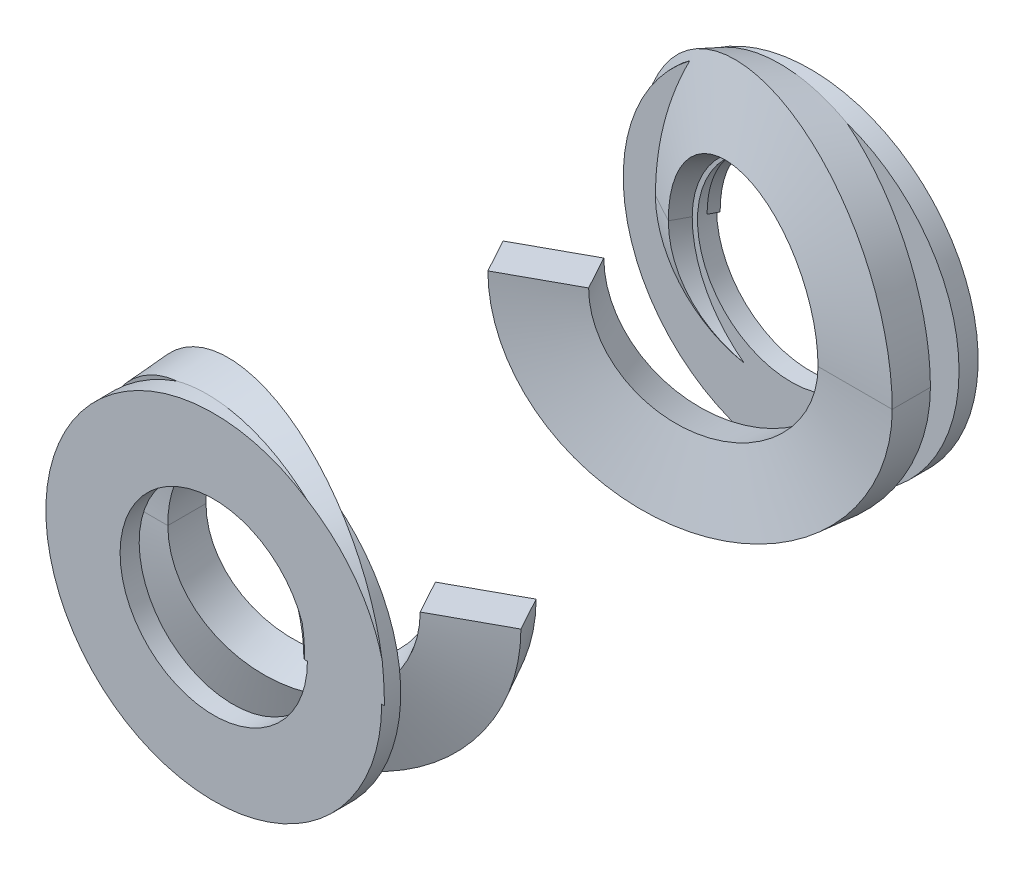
SolidWorks part; units mm, degrees
ref_plane "Front" through (0, 0, 0) normal (0, 0, 1) x (1, 0, 0)
ref_plane "Top" through (0, 0, 0) normal (0, 1, 0) x (1, 0, 0)
ref_plane "Right" through (0, 0, 0) normal (1, 0, 0) x (0, 0, -1)
sketch "Logo3_Revol_Axis" plane through (0, 0, 0) normal (0, 1, 0) x (1, 0, 0)
  line L0 (0, -30.1034) -> (0, 30.1034) construction
sketch "Logo3_bib0" plane through (0, 0, 0) normal (0, 1, 0) x (1, 0, 0)
  line L0 (-12.7, 0) -> (12.7, 0) construction
  line L1 (0, 0) -> (0, 42.862) construction
  dimension "logo3_d1" = 25.4
  dimension "logo3_l1" = 42.862
sketch "logo3_bib1" plane through (0, 0, 0) normal (0, 1, 0) x (1, 0, 0)
  line L0 (-12.7, 0) -> (12.7, 0) construction
  line L1 (12.7, 0) -> (12.7, 42.862) construction
  line L2 (12.7, 42.862) -> (-12.7, 42.862) construction
  line L3 (-12.7, 42.862) -> (-12.7, 0) construction
  line L4 (12.065, 0) -> (12.065, 42.862) construction
  line L5 (-12.065, 44.2336) -> (-12.065, 0) construction
  line L6 (6.731, 0) -> (6.731, 42.862) construction
  line L7 (-6.731, 0) -> (-6.731, 44.2336) construction
  line L8 (0, 0) -> (0, 42.862) construction
  line L9 (9.398, 42.862) -> (9.398, 0) construction
  line L10 (-9.398, 42.862) -> (-9.398, 0) construction
  line L11 (9.398, 0) -> (-9.398, 4.8006) construction
  line L12 (0, 2.4003) -> (0.7424, 5.307) construction
  line L13 (-9.398, 4.8006) -> (9.398, 9.6012) construction
  line L14 (-9.398, 42.862) -> (9.398, 38.0614) construction
  line L15 (9.398, 9.6012) -> (-9.398, 14.4018) construction
  line L16 (0, 7.2009) -> (-0.7424, 10.1076) construction
  line L17 (0, 12.0015) -> (0.7424, 14.9082) construction
  line L18 (0, 40.4617) -> (-0.7424, 37.555) construction
  line L19 (-22.523, 52.4632) -> (29.4917, 52.4632) construction
  line L20 (-22.523, -19.2024) -> (25.6601, -19.2024) construction
  line L21 (9.398, 38.0614) -> (-9.398, 33.2608) construction
  line L22 (0, 35.6611) -> (0.7424, 32.7544) construction
  line L23 (0, 0) -> (-0.7424, 2.9067) construction
  line L24 (-12.065, 44.2336) -> (-6.731, 44.2336)
  line L25 (-12.065, 44.2336) -> (-12.065, 41.4904)
  line L26 (-12.065, 41.4904) -> (-6.731, 41.4904)
  line L27 (-6.731, 44.2336) -> (-6.731, 41.4904)
  line L28 (6.731, -1.3716) -> (12.065, -1.3716)
  line L29 (6.731, -1.3716) -> (6.731, 1.3716)
  line L30 (6.731, 1.3716) -> (12.065, 1.3716)
  line L31 (12.065, -1.3716) -> (12.065, 1.3716)
  line L32 (0, 42.862) -> (0.7424, 39.9553) construction
  circle A1 centre (9.398, 38.0614) radius 2.667
  circle A2 centre (9.398, 9.6012) radius 2.667
  circle A4 centre (-9.398, 4.8006) radius 2.667
  circle A5 centre (-9.398, 14.4018) radius 2.667
  circle A6 centre (-9.398, 33.2608) radius 2.667
sketch "Sketch4" plane through (0, 0, 0) normal (0, 1, 0) x (1, 0, 0)
  line L0 (0, 0) -> (0, 42.862) construction
  line L1 (0, 0) -> (0, 42.862) construction
  line L2 (-12.065, 44.2336) -> (-12.065, 41.4904) construction
  line L3 (-12.065, 41.4904) -> (-6.731, 41.4904) construction
  line L4 (-6.731, 44.2336) -> (-6.731, 41.4904) construction
  line L5 (-12.065, 44.2336) -> (-6.731, 44.2336) construction
  line L6 (-12.065, 44.2336) -> (-12.065, 41.4904)
  line L7 (-12.065, 41.4904) -> (-6.731, 41.4904)
  line L8 (-6.731, 44.2336) -> (-6.731, 41.4904)
  line L9 (-12.065, 44.2336) -> (-6.731, 44.2336)
  line L10 (6.731, -1.3716) -> (6.731, 1.3716) construction
  line L11 (6.731, 1.3716) -> (12.065, 1.3716) construction
  line L12 (12.065, -1.3716) -> (12.065, 1.3716) construction
  line L13 (6.731, -1.3716) -> (12.065, -1.3716) construction
  line L14 (6.731, -1.3716) -> (6.731, 1.3716)
  line L15 (6.731, 1.3716) -> (12.065, 1.3716)
  line L16 (12.065, -1.3716) -> (12.065, 1.3716)
  line L17 (6.731, -1.3716) -> (12.065, -1.3716)
revolve "Revolve2" add sketch "Sketch4" angle 360 about L1
sketch "Sketch5" plane through (0, 0, 0) normal (0, -1, 0) x (1, 0, 0)
  line L0 (0, -2.4003) -> (0.7424, -5.307) construction
  line L1 (0, -2.4003) -> (0.7424, -5.307) construction
  line L2 (-12.065, -44.2336) -> (-12.065, 0) construction
  line L3 (-6.731, 0) -> (-6.731, -44.2336) construction
  line L7 (-12.065, -3.429) -> (-6.731, -3.429)
  line L8 (-12.065, -3.429) -> (-12.065, -6.1722)
  line L9 (-12.065, -6.1722) -> (-6.731, -6.1722)
  line L10 (-6.731, -3.429) -> (-6.731, -6.1722)
revolve "Revolve3" add sketch "Sketch5" angle 180 about L1
sketch "Sketch6" plane through (0, 0, 0) normal (0, 1, 0) x (1, 0, 0)
  line L0 (0, 7.2009) -> (-0.7424, 10.1076) construction
  line L1 (0, 7.2009) -> (-0.7424, 10.1076) construction
  line L6 (-6.731, 6.1722) -> (-6.731, 3.429) construction
  line L7 (-12.065, 6.1722) -> (-6.731, 6.1722) construction
  line L8 (-12.065, 3.429) -> (-12.065, 6.1722) construction
  line L9 (-6.731, 3.429) -> (-12.065, 3.429) construction
  line L10 (-6.731, 6.1722) -> (-6.731, 3.429)
  line L11 (-12.065, 6.1722) -> (-6.731, 6.1722)
  line L12 (-12.065, 3.429) -> (-12.065, 6.1722)
  line L13 (-6.731, 3.429) -> (-12.065, 3.429)
revolve "Revolve4" add sketch "Sketch6" angle 180 about L1
sketch "Sketch11" plane through (0, 0, 0) normal (0, 1, 0) x (1, 0, 0)
  line L0 (6.3999, 0.0753) -> (11.0806, -2.4825) construction
  line L1 (9.0477, -1.3716) -> (11.0806, -2.4825)
  line L3 (11.0806, -2.4825) -> (12.3961, -0.0753) construction
  line L4 (0, 0) -> (-0.7424, 2.9067) construction
  line L5 (0, 0) -> (-0.7424, 2.9067) construction
  line L7 (11.0806, -2.4825) -> (11.6877, -1.3716)
  line L8 (6.731, -1.3716) -> (12.065, -1.3716) construction
  line L10 (9.0477, -1.3716) -> (11.6877, -1.3716)
revolve "Revolve8" add sketch "Sketch11" angle 90 about L5
sketch "Sketch8" plane through (0, 0, 0) normal (0, 1, 0) x (1, 0, 0)
  line L0 (0, 40.4617) -> (-0.7424, 37.555) construction
  line L1 (0, 40.4617) -> (-0.7424, 37.555) construction
  line L2 (12.065, 0) -> (12.065, 42.862) construction
  line L3 (6.731, 0) -> (6.731, 42.862) construction
  line L11 (12.065, 39.433) -> (6.731, 39.433)
  line L12 (12.065, 39.433) -> (12.065, 36.6898)
  line L13 (12.065, 36.6898) -> (6.731, 36.6898)
  line L14 (6.731, 39.433) -> (6.731, 36.6898)
revolve "Revolve6" add sketch "Sketch8" angle 180 about L1
sketch "Sketch10" plane through (0, 0, 0) normal (0, 1, 0) x (1, 0, 0)
  line L0 (0, 35.6611) -> (0.7424, 32.7544) construction
  line L1 (0, 35.6611) -> (0.7424, 32.7544) construction
  line L11 (12.065, 36.6898) -> (12.065, 39.433)
  line L12 (6.731, 36.6898) -> (12.065, 36.6898)
  line L13 (6.731, 39.433) -> (6.731, 36.6898)
  line L14 (12.065, 39.433) -> (6.731, 39.433)
  line L15 (12.065, 36.6898) -> (12.065, 39.433)
  line L16 (6.731, 36.6898) -> (12.065, 36.6898)
  line L17 (6.731, 39.433) -> (6.731, 36.6898)
  line L18 (12.065, 39.433) -> (6.731, 39.433)
  dimension "D1" = 0
revolve "Revolve7" add sketch "Sketch10" angle 180 about L1
sketch "Sketch13" plane through (0, 0, 0) normal (0, 1, 0) x (1, 0, 0)
  line L0 (-6.3999, 42.7867) -> (-7.7154, 40.3795) construction
  line L1 (-7.7154, 40.3795) -> (-12.3961, 42.9373) construction
  line L2 (-7.1083, 41.4904) -> (-7.7154, 40.3795)
  line L3 (-7.7154, 40.3795) -> (-9.7483, 41.4904)
  line L4 (-12.065, 41.4904) -> (-6.731, 41.4904) construction
  line L5 (-9.7483, 41.4904) -> (-7.1083, 41.4904)
  line L6 (0, 42.862) -> (0.7424, 39.9553) construction
  line L7 (0, 42.862) -> (0.7424, 39.9553) construction
revolve "Revolve9" add sketch "Sketch13" angle 90 about L7
sketch "Sketch9" plane through (0, 0, 0) normal (0, 1, 0) x (1, 0, 0)
  line L0 (12.7, 0) -> (12.7, 42.862) construction
  line L1 (-12.7, 0) -> (12.7, 0)
  line L2 (-12.7, 0) -> (-12.7, -19.2024)
  line L3 (-12.7, -19.2024) -> (12.7, -19.2024)
  line L4 (12.7, 0) -> (12.7, -19.2024)
  line L5 (-12.7, 42.862) -> (-12.7, 0) construction
  line L6 (12.7, 42.862) -> (-12.7, 42.862)
  line L7 (12.7, 42.862) -> (12.7, 52.4632)
  line L8 (12.7, 52.4632) -> (-12.7, 52.4632)
  line L9 (-12.7, 42.862) -> (-12.7, 52.4632)
  line L10 (-22.523, -19.2024) -> (25.6601, -19.2024) construction
  line L11 (-22.523, 52.4632) -> (29.4917, 52.4632) construction
extrude "Cut-Extrude1" cut sketch "Sketch9" against normal through all and the other way through all
sketch "Sketch14" plane through (0, 0, 0) normal (0, 1, 0) x (1, 0, 0)
  line L0 (9.398, 42.862) -> (9.398, 0) construction
  line L1 (-9.398, 42.862) -> (-9.398, 0) construction
  line L2 (9.398, 42.862) -> (9.398, 0) construction
  line L3 (-9.398, 42.862) -> (-9.398, 0) construction
equation "\"Ray1@logo3_bib1\" = \"Logo3_d2*1.06/2@logo3_bib1\""
equation "\"Ray2@logo3_bib1\" = \"Logo3_(d1-(.1*d2))/2@logo3_bib1\""
equation "\"Ray3@logo3_bib1\" = (\"Ray1@logo3_bib1\"+\"Ray2@logo3_bib1\")/2"
equation "\"Ray3bis@logo3_bib1\" = \"Ray3@logo3_bib1\""
equation "\"Dist1@logo3_bib1\" = (\"Logo3_(d1-(.1*d2))/2@logo3_bib1\"-\"Logo3_d2*1.06/2@logo3_bib1\")*.9"
equation "\"Dist2@logo3_bib1\" = \"Dist1@logo3_bib1\"*2"
equation "\"Dist3@logo3_bib1\" = \"Dist1@logo3_bib1\"*3"
equation "\"Dist1bis@logo3_bib1\" = \"Dist1@logo3_bib1\""
equation "\"Dist4@logo3_bib1\" = \"Dist1@logo3_bib1\"*2"
equation "\"Dist5@logo3_bib1\" = \"Dist4@logo3_bib1\"*2"
equation "\"Dist2bis@logo3_bib1\" = \"Dist2@logo3_bib1\""
equation "\"EpBrin@logo3_bib1\" = \"Dist1bis@logo3_bib1\"/3.5"
equation "\"EpBrin_1@logo3_bib1\" = \"EpBrin@logo3_bib1\""
equation "\"EpBrin_2@logo3_bib1\" = \"EpBrin@logo3_bib1\""
equation "\"EpBrin_3@logo3_bib1\" = \"EpBrin@logo3_bib1\""
equation "\"EpBrin_1@Sketch5\" = \"EpBrin@logo3_bib1\""
equation "\"EpBrin_2@Sketch5\" = \"EpBrin@logo3_bib1\""
equation "\"EpBrin_1@Sketch8\" = \"EpBrin@logo3_bib1\""
equation "\"EpBrin_2@Sketch8\" = \"EpBrin@logo3_bib1\""
